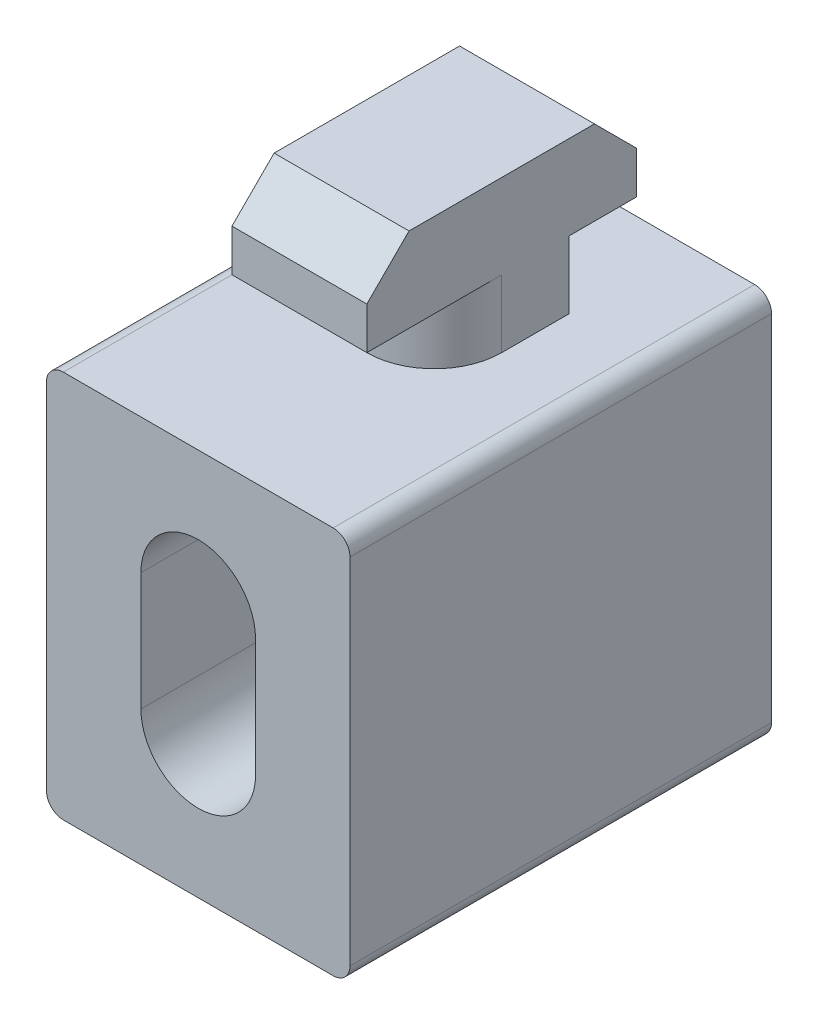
SolidWorks part; units mm, degrees
ref_plane "前视基准面" through (0, 0, 0) normal (0, 0, 1) x (1, 0, 0)
ref_plane "上视基准面" through (0, 0, 0) normal (0, 1, 0) x (1, 0, 0)
ref_plane "右视基准面" through (0, 0, 0) normal (1, 0, 0) x (0, 0, -1)
sketch "草图1" plane through (0, 0, 0) normal (0, 0, 1) x (1, 0, 0)
  line L1 (-9, 11.5) -> (9, 11.5)
  line L2 (-9, 11.5) -> (-9, -11.5)
  line L3 (-9, -11.5) -> (9, -11.5)
  line L4 (9, 11.5) -> (9, -11.5)
  line L5 (-9, 11.5) -> (9, -11.5) construction
  line L6 (-9, -11.5) -> (9, 11.5) construction
  point P0 (0, 0)
  dimension "D1" = 18
  dimension "D2" = 23
extrude "凸台-拉伸1" add sketch "草图1" along normal mid plane 25
sketch "草图2" plane through (0, 0, 12.5) normal (0, 0, 1) x (1, 0, 0)
  line L0 (0, 0) -> (0, 16.5491) construction
  line L1 (0, 0) -> (0, -18.4067) construction
  line L2 (-13.7909, 0) -> (20.996, 0) construction
  line L3 (0, 3.5) -> (0, -3.5) construction
  line L4 (3.4, 3.5) -> (3.4, -3.5)
  line L5 (-3.4, 3.5) -> (-3.4, -3.5)
  arc A0 (3.4, 3.5) -> (-3.4, 3.5) centre (0, 3.5) ccw
  arc A1 (-3.4, -3.5) -> (3.4, -3.5) centre (0, -3.5) ccw
  point P8 (0, 0)
  dimension "D1" = 3.4
  dimension "D2" = 7
extrude "切除-拉伸1" cut sketch "草图2" against normal blind 25
sketch "草图3" plane through (0, -11.5, 0) normal (0, -1, 0) x (1, 0, 0)
  line L0 (0, 0) -> (0, 13.469) construction
  line L1 (0, 13.469) -> (0, -14.3188) construction
  line L2 (0, 0) -> (0.4249, 0) construction
  line L3 (16.1034, 0) -> (-15.6785, 0) construction
  line L5 (-5, 1.5) -> (5, 1.5)
  line L6 (-5, 1.5) -> (-5, -3.5)
  line L7 (-5, -3.5) -> (5, -3.5)
  line L8 (5, 1.5) -> (5, -3.5)
  line L9 (-5, 1.5) -> (5, -3.5) construction
  line L10 (-5, -3.5) -> (5, 1.5) construction
  point P7 (0, -1)
  dimension "D1" = 10
  dimension "D2" = 5
  dimension "D3" = 11
extrude "切除-拉伸2" cut sketch "草图3" against normal blind 18
sketch "草图4" plane through (0, 11.5, 0) normal (0, 1, 0) x (1, 0, 0)
  line L0 (0, 0) -> (0, 3) construction
  line L2 (0, 5.5) -> (4, 5.5)
  line L3 (-4, 1.5) -> (-4, -2.5)
  line L4 (-4, -2.5) -> (0, -2.5)
  line L5 (4, 5.5) -> (4, 1.5)
  line L6 (-4, 5.5) -> (4, -2.5) construction
  line L7 (-4, -2.5) -> (4, 5.5) construction
  arc A0 (0, -2.5) -> (4, 1.5) centre (0, 1.5) ccw
  arc A1 (0, 5.5) -> (-4, 1.5) centre (0, 1.5) ccw
  point P3 (0, 1.5)
  dimension "D1" = 8
  dimension "D2" = 8
  dimension "D3" = 7
extrude "凸台-拉伸2" add sketch "草图4" along normal blind 4
sketch "草图5" plane through (0, 15.5, 0) normal (0, 1, 0) x (1, 0, 0)
  line L1 (-4, 9.5) -> (4, 9.5)
  line L2 (-4, 9.5) -> (-4, -6.5)
  line L3 (-4, -6.5) -> (4, -6.5)
  line L4 (4, 9.5) -> (4, -6.5)
  line L5 (-4, 9.5) -> (4, -6.5) construction
  line L6 (-4, -6.5) -> (4, 9.5) construction
  point P0 (0, 1.5)
  dimension "D1" = 8
  dimension "D2" = 16
extrude "凸台-拉伸3" add sketch "草图5" along normal blind 5
chamfer "倒角1" distance 2.5 angle 45 2 edges at (0, 20.5, -9.5) (0, 20.5, 6.5)
fillet "圆角1" radius 1 4 edges at (-9, -11.5, 0) (9, -11.5, 0) (9, 11.5, 0) (-9, 11.5, 0)
